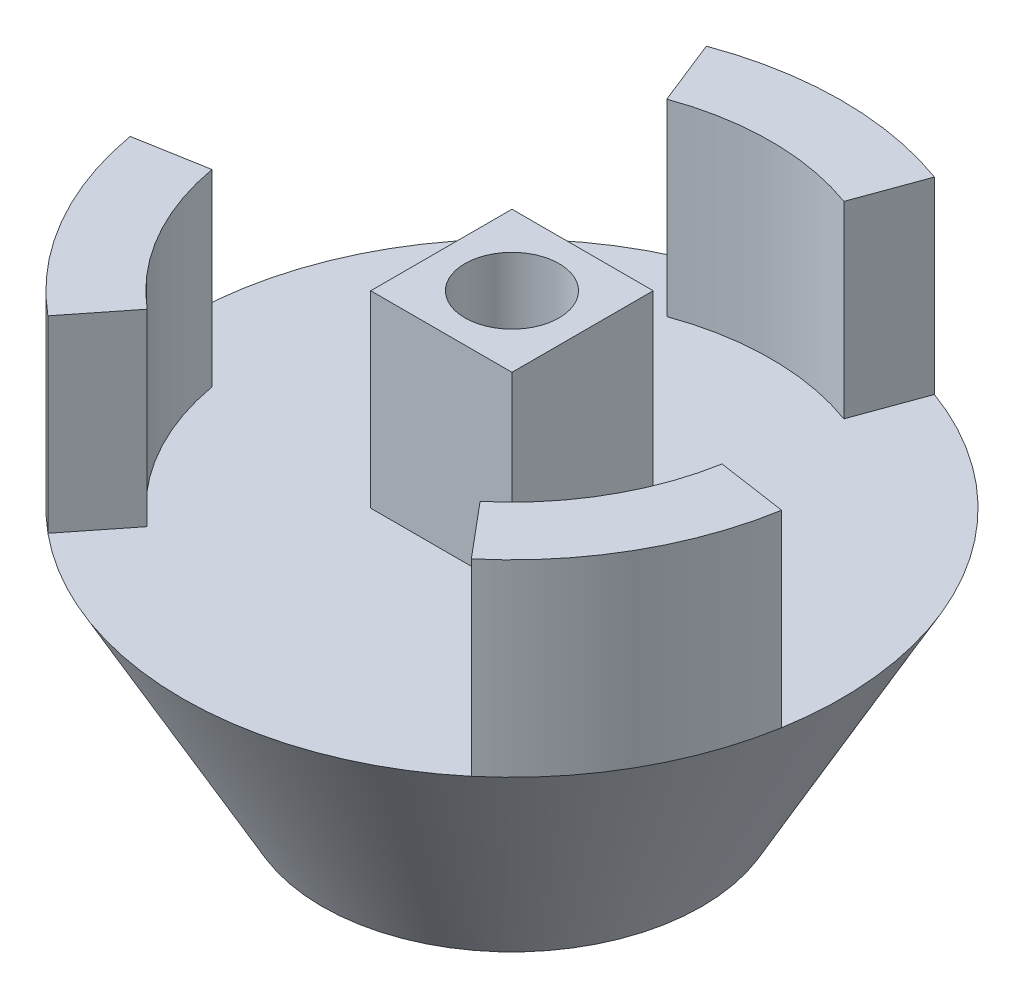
SolidWorks part; units mm, degrees
ref_plane "Front Plane" through (0, 0, 0) normal (0, 0, 1) x (1, 0, 0)
ref_plane "Top Plane" through (0, 0, 0) normal (0, 1, 0) x (1, 0, 0)
ref_plane "Right Plane" through (0, 0, 0) normal (1, 0, 0) x (0, 0, -1)
sketch "Sketch1" plane through (0, 0, 0) normal (0, 0, 1) x (1, 0, 0)
  line L0 (0, -350.3302) -> (0, 17166.1801) construction
  line L1 (3.8862, 7.1437) -> (3.8862, 0.762)
  line L2 (0, 0) -> (3.8862, 0) construction
  line L3 (0, 0) -> (0, 7.1437) construction
  line L4 (0, 7.1437) -> (3.8862, 7.1437) construction
  line L5 (3.8862, 0) -> (3.8862, 7.1437) construction
  line L6 (4.6482, 0) -> (10.2362, 0)
  line L7 (3.8862, 7.1437) -> (0, 7.1437)
  line L8 (0, 7.1437) -> (0, 13.4938)
  line L9 (0, 13.4938) -> (17.78, 13.4938) construction
  line L10 (10.2362, 0) -> (17.78, 13.4938)
  line L11 (0, 13.4938) -> (17.78, 13.4938)
  arc A0 (3.8862, 0.762) -> (4.6482, 0) centre (4.6482, 0.762) ccw
  dimension "D4" = 0.762
  dimension "D1" = 3.8862
  dimension "D2" = 7.1437
  dimension "D3" = 6.35
revolve "Revolve1" add sketch "Sketch1" angle 360 about L0
sketch "Sketch2" plane through (0, 13.4938, 0) normal (0, 1, 0) x (1, 0, 0)
  line L0 (0, 0) -> (0, 17.78) construction
  line L1 (-3.81, -3.81) -> (3.81, -3.81)
  line L2 (-3.81, -3.81) -> (-3.81, 3.81)
  line L3 (-3.81, 3.81) -> (3.81, 3.81)
  line L4 (3.81, -3.81) -> (3.81, 3.81)
  line L5 (-3.81, -3.81) -> (3.81, 3.81) construction
  line L6 (-3.81, 3.81) -> (3.81, -3.81) construction
  line L7 (0, 0) -> (6.0811, 16.7077) construction
  line L8 (0, 0) -> (-6.0811, 16.7077) construction
  line L9 (-6.183, 16.6703) -> (-4.778, 13.1275)
  line L10 (4.778, 13.1275) -> (6.0811, 16.7077)
  line L11 (17.5284, -2.9806) -> (13.7578, -2.4259)
  line L12 (8.9797, -10.7016) -> (11.4288, -13.6203)
  line L13 (-11.3454, -13.6898) -> (-8.9797, -10.7016)
  line L14 (-13.7578, -2.4259) -> (-17.5099, -3.0875)
  circle A0 centre (0, 0) radius 2.54 construction
  circle A1 centre (0, 0) radius 13.97 construction
  circle A2 centre (0, 0) radius 17.78 construction
  arc A3 (-4.778, 13.1275) -> (4.778, 13.1275) centre (0, 0) cw
  arc A4 (6.0811, 16.7077) -> (-6.183, 16.6703) centre (0, 0) ccw
  arc A5 (13.7578, -2.4259) -> (8.9797, -10.7016) centre (0, 0) cw
  arc A6 (11.4288, -13.6203) -> (17.5284, -2.9806) centre (0, 0) ccw
  arc A7 (-8.9797, -10.7016) -> (-13.7578, -2.4259) centre (0, 0) cw
  arc A8 (-17.5099, -3.0875) -> (-11.3454, -13.6898) centre (0, 0) ccw
  point P25 (0, 0)
  dimension "D1" = 7.62
  dimension "D2" = 7.62
  dimension "D3" = 3
extrude "Boss-Extrude1" add sketch "Sketch2" along normal blind 10.16
hole_wizard "#34 (0.111) Diameter Hole1" positions "Sketch3" profile "Sketch4" hole size "#34" standard "ANSI Inch"
sketch "Sketch3" plane through (0, 23.6538, 0) normal (0, 1, 0) x (1, 0, 0)
  point P0 (0, 0)
sketch "Sketch4" plane through (0, 23.6538, 0) normal (1, 0, 0) x (0, 0, 1)
  line L0 (0, 0) -> (0, 23.6538)
  line L1 (0, 23.6538) -> (2.54, 23.6538)
  line L2 (2.54, 23.6538) -> (2.54, 0)
  line L5 (2.54, 0) -> (0, 0)
  line L11 (0, -6.35) -> (0, 107.95) construction
  dimension "Thru Hole Dia." = 5.08
  dimension "Thru Hole Depth" = 23.6538
